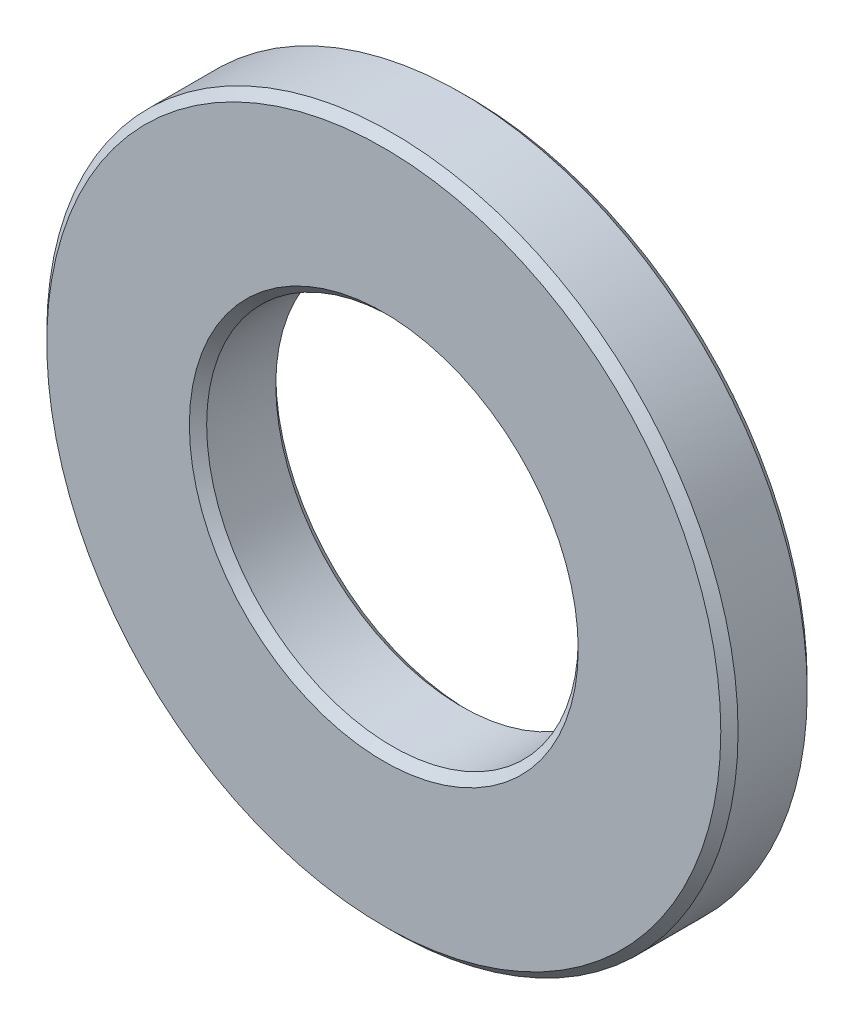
SolidWorks part; units mm, degrees
ref_plane "Front Plane" through (0, 0, 0) normal (0, 0, 1) x (1, 0, 0)
ref_plane "Top Plane" through (0, 0, 0) normal (0, 1, 0) x (1, 0, 0)
ref_plane "Right Plane" through (0, 0, 0) normal (1, 0, 0) x (0, 0, -1)
sketch "Sketch1" plane through (0, 0, 0) normal (0, 0, 1) x (1, 0, 0)
  circle A0 centre (0, 0) radius 4
  circle A1 centre (0, 0) radius 2.15
  dimension "D1" = 8
  dimension "D2" = 4.3
extrude "Boss-Extrude2" add sketch "Sketch1" along normal mid plane 1
chamfer "Chamfer3" distance 0.1 angle 45 4 edges at (4, 0, 0.5) (4, 0, -0.5) (2.15, 0, -0.5) (2.15, 0, 0.5)
